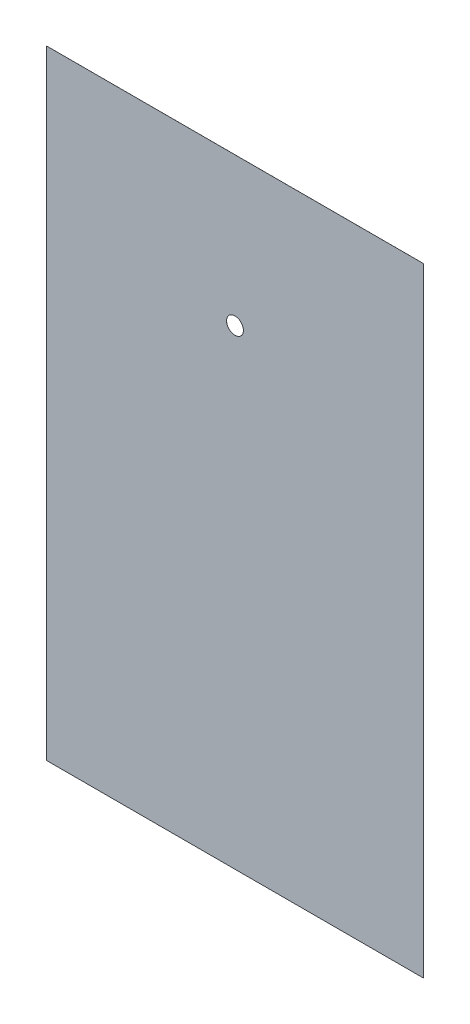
SolidWorks part; units mm, degrees
ref_plane "Front Plane" through (0, 0, 0) normal (0, 0, 1) x (1, 0, 0)
ref_plane "Top Plane" through (0, 0, 0) normal (0, 1, 0) x (1, 0, 0)
ref_plane "Right Plane" through (0, 0, 0) normal (1, 0, 0) x (0, 0, -1)
sketch "Sketch1" plane through (0, 0, 0) normal (0, 0, 1) x (1, 0, 0)
  line L1 (-25.4, 25.4) -> (25.4, 25.4)
  line L2 (-25.4, 25.4) -> (-25.4, -25.4)
  line L3 (-25.4, -25.4) -> (25.4, -25.4)
  line L4 (25.4, 25.4) -> (25.4, -25.4)
  line L5 (-25.4, 25.4) -> (25.4, -25.4) construction
  line L6 (-25.4, -25.4) -> (25.4, 25.4) construction
  circle A0 centre (0, 0) radius 7.9375
  point P0 (0, 0)
  dimension "D3" = 15.875
  dimension "D1" = 50.8
  dimension "D2" = 50.8
extrude "Boss-Extrude1" add sketch "Sketch1" along normal blind 0.0254
sketch "Sketch2" plane through (0, 0, 0.0254) normal (0, 0, 1) x (1, 0, 0)
  line L0 (0, 0) -> (0, -444.5) construction
  line L1 (-177.8, 139.7) -> (177.8, 139.7)
  line L2 (-177.8, 139.7) -> (-177.8, -444.5)
  line L3 (-177.8, -444.5) -> (177.8, -444.5)
  line L4 (25.4, -25.4) -> (25.4, 25.4)
  line L5 (25.4, 25.4) -> (-25.4, 25.4)
  line L6 (-25.4, 25.4) -> (-25.4, -25.4)
  line L7 (-25.4, -25.4) -> (25.4, -25.4)
  line L8 (25.4, -25.4) -> (25.4, 25.4)
  line L9 (25.4, 25.4) -> (-25.4, 25.4)
  line L10 (-25.4, 25.4) -> (-25.4, -25.4)
  line L11 (-25.4, -25.4) -> (25.4, -25.4)
  line L12 (177.8, 139.7) -> (177.8, -444.5)
  circle A0 centre (0, 0) radius 7.9375 construction
  dimension "D2" = 139.7
  dimension "D3" = 584.2
  dimension "D4" = 355.6
  dimension "D1" = 0
extrude "Boss-Extrude2" add sketch "Sketch2" against normal up to surface (0.0254 mm away)
sketch "Sketch3" plane through (0, 0, 0.0254) normal (0, 0, 1) x (1, 0, 0)
  line L8 (-165.1, 127) -> (-165.1, -431.8)
  line L9 (-165.1, -431.8) -> (165.1, -431.8)
  line L10 (165.1, -431.8) -> (165.1, 127)
  line L11 (165.1, 127) -> (-165.1, 127)
  line L12 (-165.1, 127) -> (-165.1, -431.8)
  line L13 (-165.1, -431.8) -> (165.1, -431.8)
  line L14 (165.1, -431.8) -> (165.1, 127)
  line L15 (165.1, 127) -> (-165.1, 127)
  dimension "D1" = 12.7
